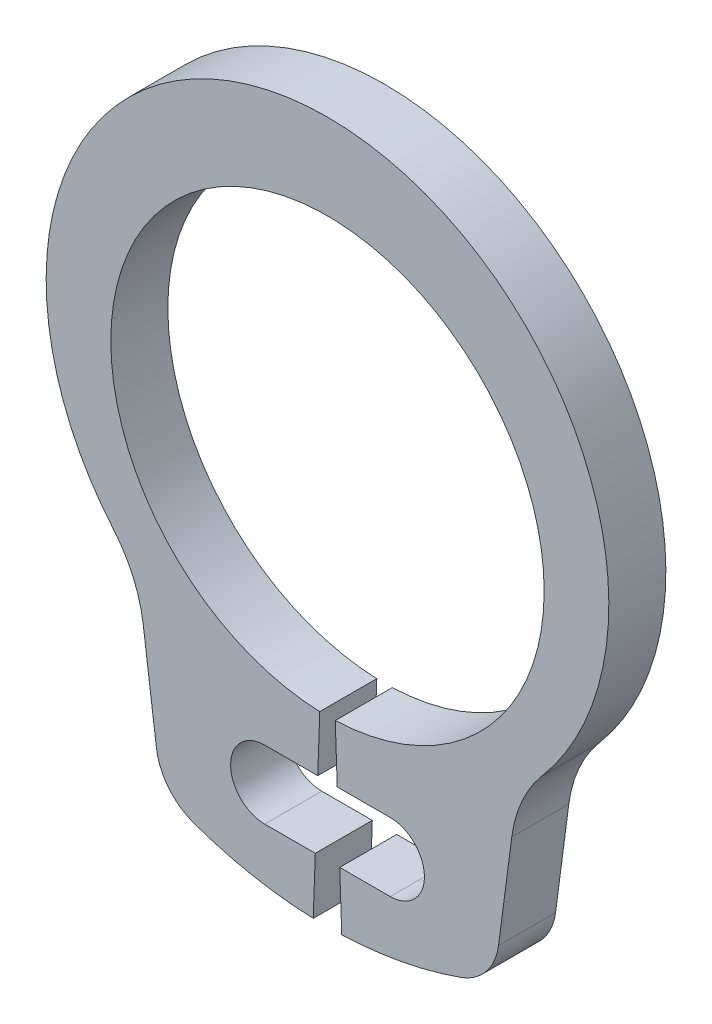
SolidWorks part; units mm, degrees
ref_plane "Plane1" through (0, 0, 0) normal (0, 0, 1) x (1, 0, 0)
ref_plane "Plane2" through (0, 0, 0) normal (0, 1, 0) x (1, 0, 0)
ref_plane "Plane3" through (0, 0, 0) normal (1, 0, 0) x (0, 0, -1)
sketch "Clipboard" plane through (0, 0, 0) normal (0, 0, 1) x (1, 0, 0)
  line L0 (0, 0) -> (1.5, 0)
  line L1 (0, 0) -> (0, 0.9)
  line L2 (0, 0) -> (0, -3.2)
  circle A0 centre (0, 0) radius 0.6
  circle A1 centre (0, 0) radius 4
sketch "BodySke" plane through (0, 0, 0) normal (0, 0, 1) x (1, 0, 0)
  line L0 (-1.5431, 0) -> (1.5431, 0) construction
  line L1 (0, 0) -> (0, 5.3) construction
  line L2 (0.1357, -3.7976) -> (0.25, -6.9955)
  line L3 (-0.1357, -3.7976) -> (-0.25, -6.9955)
  line L4 (0, 0) -> (5.5098, -4.3177) construction
  line L5 (0, 0) -> (-5.5098, -4.3177) construction
  line L7 (3.2321, -4.0178) -> (2.9995, -5.7845)
  line L8 (-3.2321, -4.0178) -> (-2.9995, -5.7845)
  circle A0 centre (0, 0) radius 3.8 construction
  arc A1 (0.1357, -3.7976) -> (-0.1357, -3.7976) centre (0, 0) ccw
  arc A2 (3.6994, -2.899) -> (-3.6994, -2.899) centre (0, 0.3659) ccw construction
  arc A3 (0.25, -6.9955) -> (2.3427, -6.5963) centre (0, 0) ccw
  arc A4 (3.7594, -2.8298) -> (3.2321, -4.0178) centre (5.5098, -4.3177) ccw
  arc A5 (-3.2321, -4.0178) -> (-3.7594, -2.8298) centre (-5.5098, -4.3177) ccw
  arc A6 (-2.3427, -6.5963) -> (-0.25, -6.9955) centre (0, 0) ccw
  arc A7 (3.7594, -2.8298) -> (-3.7594, -2.8298) centre (0, 0.3659) ccw
  arc A8 (-3.1693, -4.4951) -> (3.1693, -4.4951) centre (0, 0) ccw construction
  circle A9 centre (1.1, -5.3889) radius 0.6
  circle A10 centre (-1.1, -5.3889) radius 0.6
  arc A11 (2.9995, -5.7845) -> (2.3427, -6.5963) centre (2.0081, -5.654) cw
  arc A12 (-2.9995, -5.7845) -> (-2.3427, -6.5963) centre (-2.0081, -5.654) ccw
  point P28 (2.9237, -6.3602)
  point P31 (-2.9237, -6.3602)
extrude "Body" add sketch "BodySke" against normal blind 1
sketch "NotSke" plane through (0, 0, 0) normal (0, 0, 1) x (1, 0, 0)
  line L0 (1.1, -4.7889) -> (1.1, -5.9889)
  line L1 (1.1, -5.9889) -> (-1.1, -5.9889)
  line L2 (-1.1, -5.9889) -> (-1.1, -4.7889)
  line L3 (-1.1, -4.7889) -> (1.1, -4.7889)
  circle A0 centre (1.1, -5.3889) radius 0.6 construction
  circle A1 centre (-1.1, -5.3889) radius 0.6 construction
extrude "Notch" cut sketch "NotSke" against normal through all
sketch "UnlSke" plane through (0, 0, 0) normal (0, 0, 1) x (1, 0, 0)
  line L0 (2.3427, -2.9919) -> (2.3427, -6.5963)
  line L1 (-2.3427, -2.9919) -> (-2.3427, -6.5963)
  arc A0 (2.3427, -2.9919) -> (-2.3427, -2.9919) centre (0, 0) ccw
  arc A1 (2.3427, -6.5963) -> (-2.3427, -6.5963) centre (0, 0) ccw
  arc A4 (-2.3427, -6.5963) -> (-0.25, -6.9955) centre (0, 0) ccw construction
  arc A5 (0.1357, -3.7976) -> (-0.1357, -3.7976) centre (0, 0) ccw construction
extrude "Unlug" [suppressed] add sketch "UnlSke" against normal through all
equation "' \"ShaftDia@Clipboard\" = 3"
equation "' \"Thickness@Body\" = 0.4"
equation "' \"GrooveDia@BodySke\" = 2.8"
equation "' \"LugSection@Clipboard\" = 1.9"
equation "' \"LargeSection@Clipboard\" = 0.8"
equation "' \"HoleDia@Clipboard\" = 0.8"
equation "' \"ShaftDia@Clipboard\" = 9"
equation "' \"Thickness@Body\" = 1"
equation "' \"GrooveDia@BodySke\" = 8.6"
equation "' \"LugSection@Clipboard\" = 3.3"
equation "' \"LargeSection@Clipboard\" = 1.7"
equation "' \"HoleDia@Clipboard\" = 1.2"
equation "\"SmallSection@Clipboard\" =  \"LargeSection@Clipboard\" * 0.6"
equation "\"Gap@BodySke\" =  \"Thickness@Body\" / 2"
equation "\"LargeRad@BodySke\" =  \"GrooveDia@BodySke\" / 2 +  \"LargeSection@Clipboard\""
equation "\"SmallRad@BodySke\" =  \"GrooveDia@BodySke\" / 2 +  \"SmallSection@Clipboard\""
equation "\"LugRad@BodySke\" = \"GrooveDia@BodySke\" / 2 + \"LugSection@Clipboard\""
equation "\"HoleOffsetRad@BodySke\" = (  \"ShaftDia@Clipboard\" / 2 + \"LugRad@BodySke\" ) / 2"
equation "\"HoleSpacing@BodySke\" = \"Gap@BodySke\"  * 2 +  \"HoleDia@Clipboard\""
equation "\"HoleDia@BodySke\" =  \"HoleDia@Clipboard\""
equation "\"SmallAngle@BodySke\" = atn(\"HoleSpacing@BodySke\" / 2 / sqr(\"HoleOffsetRad@BodySke\"  * \"HoleOffsetRad@BodySke\" - (\"HoleSpacing@BodySke\" / 2) * (\"HoleSpacing@BodySke\" / 2) ))  * 9 * ( 180 / 3.141593)"
